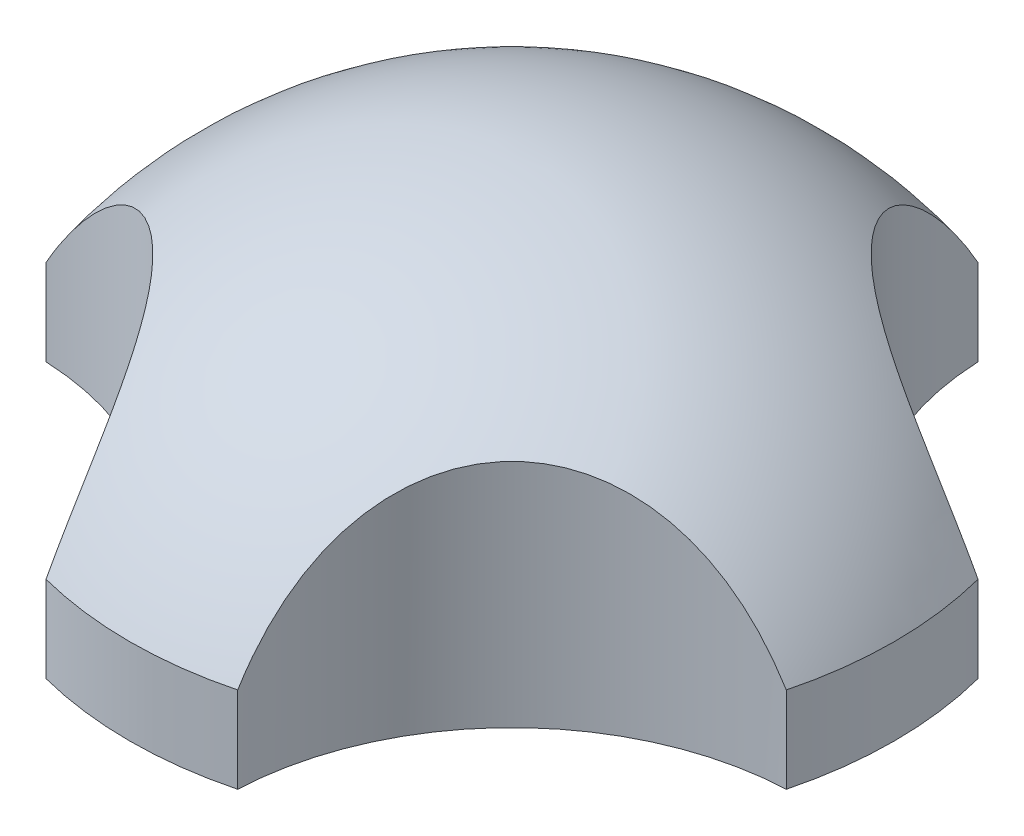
SolidWorks part; units mm, degrees
ref_plane "前视" through (0, 0, 0) normal (0, 0, 1) x (1, 0, 0)
ref_plane "上视" through (0, 0, 0) normal (0, 1, 0) x (1, 0, 0)
ref_plane "右视" through (0, 0, 0) normal (1, 0, 0) x (0, 0, -1)
sketch "草图1" plane through (0, 0, 0) normal (0, 0, 1) x (1, 0, 0)
  line L0 (0, 8) -> (0, 45.6508)
  line L1 (-40, 22) -> (-40, 13)
  line L2 (0, 0) -> (0, -18.5225) construction
  line L3 (-19, 13) -> (-19, 8)
  line L4 (-19, 8) -> (0, 8)
  line L5 (-40, 13) -> (-19, 13)
  arc A0 (-40, 22) -> (0, 45.6508) centre (0, 0) cw
  dimension "D1" = 9
  dimension "D2" = 80
  dimension "D3" = 8
  dimension "D4" = 38
  dimension "D5" = 13
revolve "旋转1" add sketch "草图1" angle 360 about L2
sketch "草图2" plane through (0, 0, 0) normal (0, 1, 0) x (1, 0, 0)
  line L0 (0, 0) -> (0, -12.991) construction
  line L1 (0, 0) -> (13.4632, 0) construction
  arc A0 (38.7228, -10.0272) -> (10.0272, -38.7228) centre (40, -40) ccw
  circle A1 centre (0, 0) radius 40 construction
  arc A2 (-38.7228, -10.0272) -> (-10.0272, -38.7228) centre (-40, -40) cw
  arc A3 (38.7228, 10.0272) -> (10.0272, 38.7228) centre (40, 40) cw
  arc A4 (-38.7228, 10.0272) -> (-10.0272, 38.7228) centre (-40, 40) ccw
  arc A5 (38.7228, 10.0272) -> (10.0272, 38.7228) centre (0, 0) ccw
  arc A6 (-10.0272, 38.7228) -> (-38.7228, 10.0272) centre (0, 0) ccw
  arc A7 (-38.7228, -10.0272) -> (-10.0272, -38.7228) centre (0, 0) ccw
  arc A8 (10.0272, -38.7228) -> (38.7228, -10.0272) centre (0, 0) ccw
  dimension "D3" = 30
  dimension "D1" = 40
  dimension "D2" = 40
extrude "切除-拉伸1" cut sketch "草图2" along normal up to surface (22 mm away)
